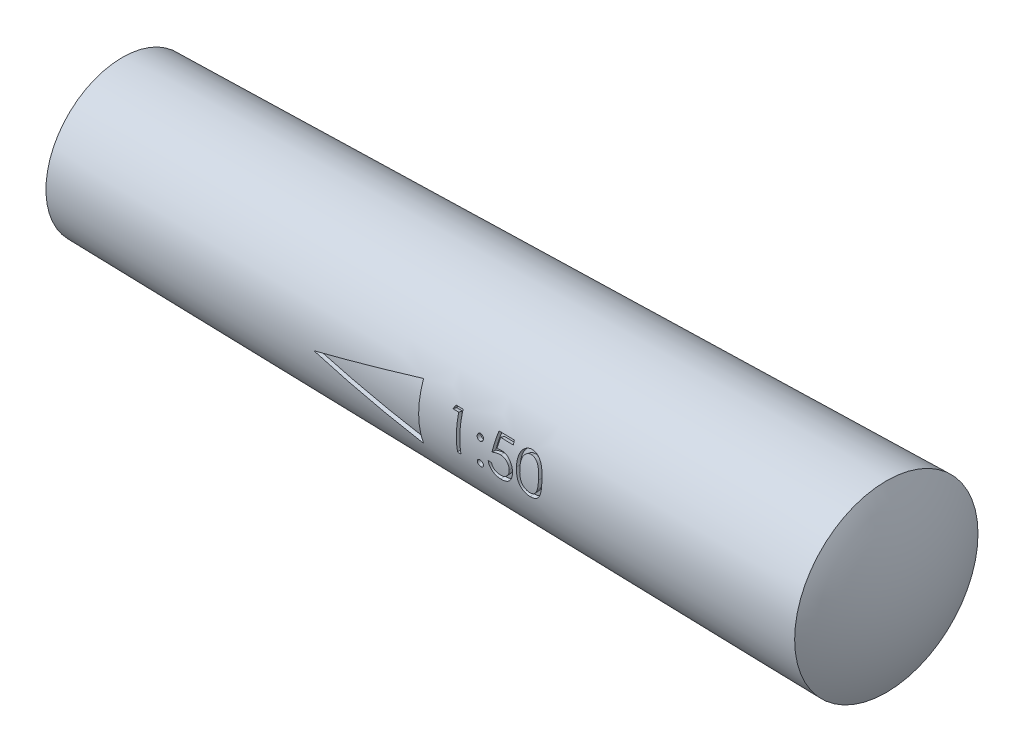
SolidWorks part; units mm, degrees
ref_plane "Front Plane" through (0, 0, 0) normal (0, 0, 1) x (1, 0, 0)
ref_plane "Top Plane" through (0, 0, 0) normal (0, 1, 0) x (1, 0, 0)
ref_plane "Right Plane" through (0, 0, 0) normal (1, 0, 0) x (0, 0, -1)
sketch "Sketch1" plane through (0, 0, 0) normal (1, 0, 0) x (0, 0, -1)
  circle A0 centre (0, 0) radius 2
  dimension "D1" = 4
extrude "Extrude1" add sketch "Sketch1" along normal mid plane 20
draft "Draft1" type of draft neutral plane draft angle 1.146 faces to draft 1 parameters "D1"=1.146
sketch "Sketch2" plane through (0, 0, 0) normal (0, 0, 1) x (1, 0, 0)
  line L0 (-10, 0) -> (-10, 2)
  line L1 (-10, 2) -> (-10, -2) construction
  line L2 (-10, 0) -> (-10.6, 0)
  line L3 (-10.6, 0) -> (-10.6, -2.2) construction
  line L4 (10, 0) -> (10, 2.4)
  line L5 (10, -2.4) -> (10, 2.4) construction
  line L6 (10, 0) -> (10.6, 0)
  line L7 (10.6, 0) -> (10.6, -2.2) construction
  line L8 (-10, -2) -> (10, -2.4) construction
  arc A0 (-10.6, 0) -> (-10, 2) centre (-6.9667, 0) cw
  arc A1 (10.6, 0) -> (10, 2.4) centre (5.4999, 0) ccw
  point P14 (0, -2.2)
revolve "Revolve1" add sketch "Sketch2" angle 360 about L2
sketch "Sketch5" plane through (0, 0, 0) normal (0, 0, 1) x (1, 0, 0)
  line L0 (0, 2.2) -> (0, -2.2) construction
  line L1 (10, 2.4) -> (-10, 2) construction
  line L2 (-10, -2) -> (10, -2.4) construction
ref_plane "Plane2" through (0, 0, 0) normal (-0.02, 0, 0.9998) x (0.9998, 0, 0.02)
sketch "Sketch6" plane through (0, 0, 0) normal (-0.02, 0, 0.9998) x (0.9998, 0, 0.02)
  line L0 (0, 0) -> (0, 0.75)
  line L1 (0, 2.2) -> (0, -2.2) construction
  line L2 (0, 0.75) -> (-2.799, 0)
  line L3 (-2.799, 0) -> (0, -0.75)
  line L4 (0, -0.75) -> (0, 0)
  line L5 (0, -0.375) -> (4, -0.375) construction
  text T0 "1:50" font "Century Gothic" height 1
  dimension "D1" = 1.5
  dimension "D2" = 30
  dimension "D3" = 4
wrap "Wrap2" sketch "Sketch6" wrap type deboss source sketch "Sketch6" thickness 0.1 parameters "D1"=0.1
equation "\"D2@Sketch2\" = \"D1@Sketch2\""
